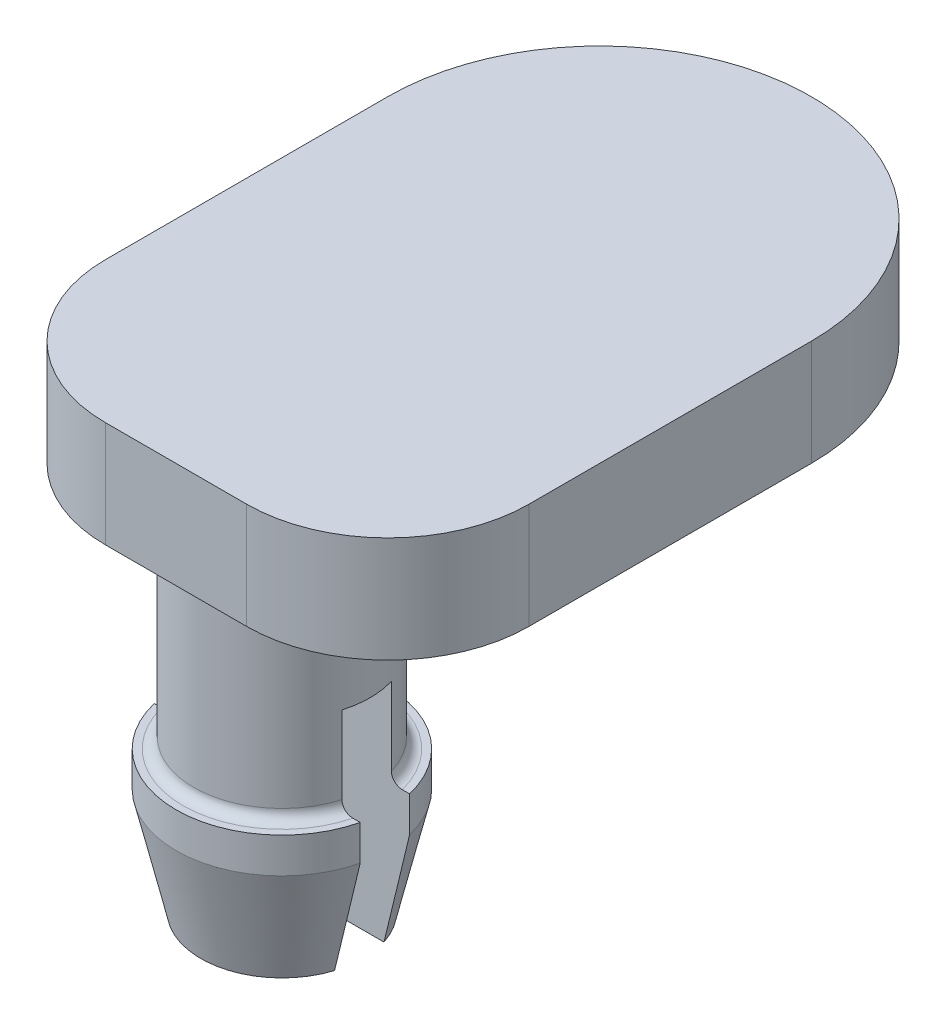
SolidWorks part; units mm, degrees
ref_plane "Front Plane" through (0, 0, 0) normal (0, 0, 1) x (1, 0, 0)
ref_plane "Top Plane" through (0, 0, 0) normal (0, 1, 0) x (1, 0, 0)
ref_plane "Right Plane" through (0, 0, 0) normal (1, 0, 0) x (0, 0, -1)
sketch "Esquisse1" plane through (0, 0, 0) normal (0, -1, 0) x (1, 0, 0)
  line L0 (-2, 3) -> (2, 3)
  line L1 (-6, -1) -> (-6, -9)
  line L3 (6, -9) -> (6, -1)
  arc A0 (-6, -1) -> (-2, 3) centre (-2, -1) cw
  arc A1 (-6, -9) -> (6, -9) centre (0, -9) ccw
  arc A2 (2, 3) -> (6, -1) centre (2, -1) cw
  point P0 (0, 3)
  dimension "D1" = 3
  dimension "D4" = 4
  dimension "D2" = 12
  dimension "D3" = 12
extrude "Boss.-Extru.1" add sketch "Esquisse1" against normal blind 3
sketch "Esquisse2" plane through (0, 0, 0) normal (0, -1, 0) x (1, 0, 0)
  circle A0 centre (0, 0) radius 2.5
  dimension "D1" = 5
extrude "Boss.-Extru.2" add sketch "Esquisse2" along normal blind 5.5
sketch "Esquisse3" plane through (0, -5.5, 0) normal (0, -1, 0) x (1, 0, 0)
  circle A0 centre (0, 0) radius 3
  dimension "D1" = 6
extrude "Boss.-Extru.3" add sketch "Esquisse3" along normal blind 4
fillet "Congé1" radius 0.3 2 edges at (0, 0, -2.5) (0, -5.5, -2.5)
chamfer "Chanfrein2" distance 3 distance2 0.7 1 edges at (0, -9.5, -3)
sketch "Esquisse4" plane through (0, -9.5, 0) normal (0, -1, 0) x (-1, 0, 0)
  line L1 (-3.7046, -0.7) -> (3.7046, -0.7)
  line L2 (-3.7046, -0.7) -> (-3.7046, 0.7)
  line L3 (-3.7046, 0.7) -> (3.7046, 0.7)
  line L4 (3.7046, -0.7) -> (3.7046, 0.7)
  line L5 (-3.7046, -0.7) -> (3.7046, 0.7) construction
  line L6 (-3.7046, 0.7) -> (3.7046, -0.7) construction
  point P0 (0, 0)
  dimension "D1" = 1.4
extrude "Enlèv. mat.-Extru.1" cut sketch "Esquisse4" against normal blind 6.5
